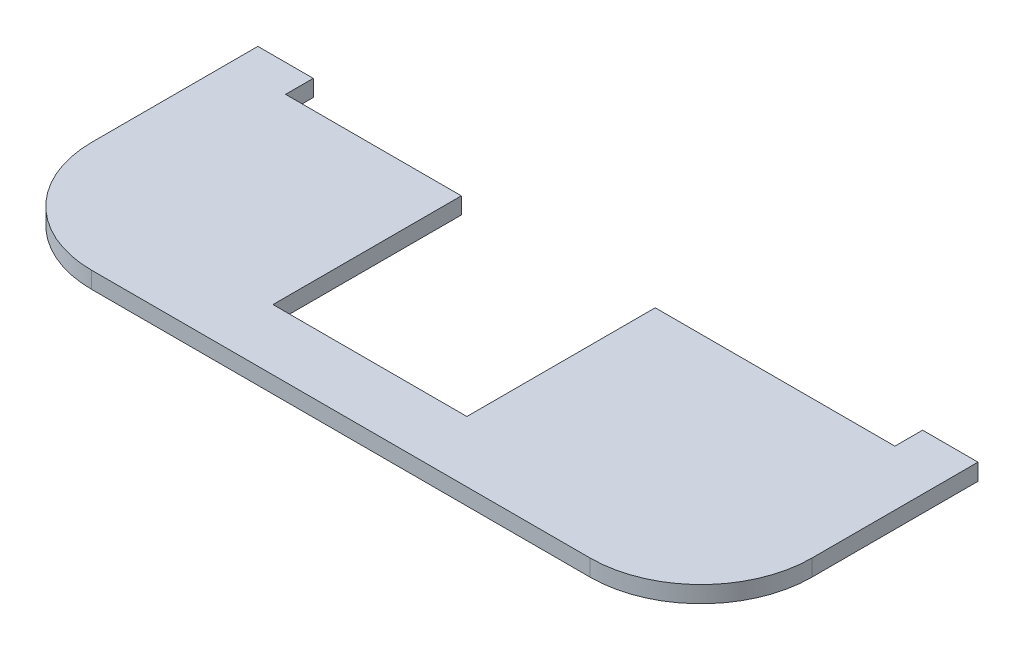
SolidWorks part; units mm, degrees
ref_plane "Alzado" through (0, 0, 0) normal (0, 0, 1) x (1, 0, 0)
ref_plane "Planta" through (0, 0, 0) normal (0, 1, 0) x (1, 0, 0)
ref_plane "Vista lateral" through (0, 0, 0) normal (1, 0, 0) x (0, 0, -1)
sketch "Sketch1" plane through (0, 0, 0) normal (0, 1, 0) x (1, 0, 0)
  line L0 (-10.8181, 35) -> (182.5653, 35) construction
  line L1 (20, 0) -> (110, 0)
  line L2 (0, 20) -> (0, 70)
  line L3 (0, 70) -> (130, 70)
  line L4 (130, 20) -> (130, 70)
  line L6 (24, 41) -> (36, 41) construction
  line L7 (24, 41) -> (24, 29) construction
  line L8 (24, 29) -> (36, 29) construction
  line L9 (36, 41) -> (36, 29) construction
  line L10 (24, 41) -> (36, 29) construction
  line L11 (24, 29) -> (36, 41) construction
  circle A1 centre (94, 35) radius 13 construction
  arc A2 (110, 0) -> (130, 20) centre (110, 20) ccw
  arc A3 (20, 0) -> (0, 20) centre (20, 20) cw
  point P7 (30, 35)
  point P16 (0, 0)
  dimension "D3" = 35
  dimension "D4" = 30
  dimension "D5" = 12
  dimension "D6" = 23
  dimension "D7" = 26
  dimension "D8" = 20
  dimension "D1" = 70
  dimension "D2" = 130
extrude "Boss-Extrude1" add sketch "Sketch1" along normal blind 3
sketch "Sketch2" plane through (0, 3, 0) normal (0, 1, 0) x (1, 0, 0)
  line L0 (130, 70) -> (0, 70) construction
  line L7 (10, 70) -> (120, 70)
  line L8 (10, 70) -> (10, 53)
  line L9 (76.7317, 50) -> (120, 50)
  line L10 (120, 70) -> (120, 50)
  line L11 (0, 70) -> (0, 20) construction
  line L12 (130, 20) -> (130, 70) construction
  line L13 (41.7317, 50) -> (41.7317, 16)
  line L18 (41.7317, 16) -> (76.7317, 16)
  line L19 (76.7317, 50) -> (76.7317, 16)
  line L21 (10, 53) -> (10, 50)
  line L22 (10, 50) -> (41.7317, 50)
  point P0 (94, 35)
  point P16 (30.9007, 35)
  dimension "D1" = 10
  dimension "D2" = 10
  dimension "D3" = 20
  dimension "D4" = 34
  dimension "D5" = 31.7317
  dimension "D6" = 35
  dimension "D7" = 20
extrude "Cut-Extrude1" cut sketch "Sketch2" against normal through all both and the other way through all
sketch "Sketch4" plane through (0, 3, 0) normal (0, 1, 0) x (1, 0, 0)
  line L7 (130, 20) -> (130, 70) construction
  line L8 (0, 70) -> (130, 70)
  line L9 (0, 70) -> (0, 55)
  line L10 (0, 55) -> (130, 55)
  line L11 (130, 70) -> (130, 55)
extrude "Cut-Extrude2" cut sketch "Sketch4" against normal blind 10
sketch "Sketch5" plane through (0, 3, 0) normal (0, 1, 0) x (1, 0, 0)
  line L1 (20, 5) -> (110, 5)
  line L4 (0, 25) -> (0, -8.8655)
  line L5 (0, -8.8655) -> (130, -8.8655)
  line L6 (130, -8.8655) -> (130, 25)
  arc A0 (110, 5) -> (130, 25) centre (110, 25) ccw
  arc A1 (20, 5) -> (0, 25) centre (20, 25) cw
extrude "Cut-Extrude3" cut sketch "Sketch5" against normal blind 10
